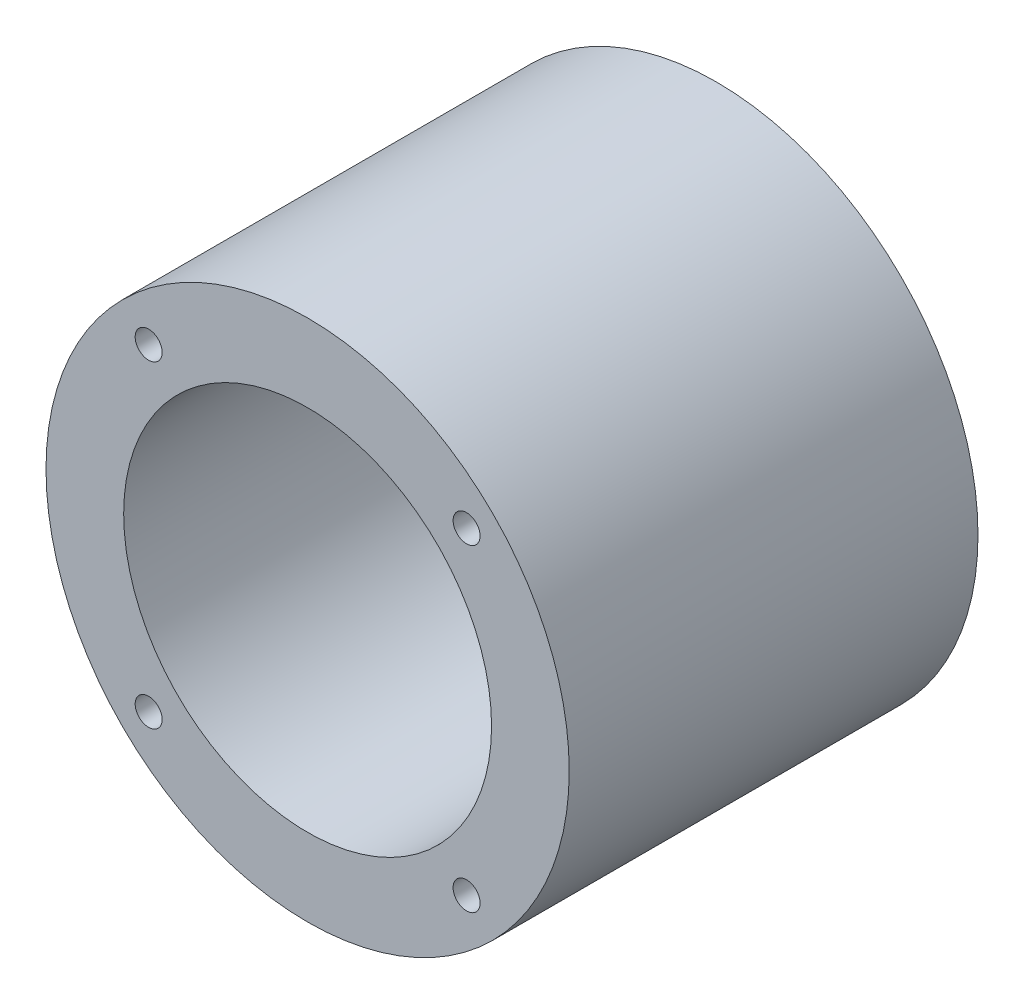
SolidWorks part; units mm, degrees
ref_plane "Ebene vorne" through (0, 0, 0) normal (0, 0, 1) x (1, 0, 0)
ref_plane "Ebene oben" through (0, 0, 0) normal (0, 1, 0) x (1, 0, 0)
ref_plane "Ebene rechts" through (0, 0, 0) normal (1, 0, 0) x (0, 0, -1)
sketch "Skizze1" plane through (0, 0, 0) normal (0, 0, 1) x (-1, 0, 0)
  line L0 (0, 72.1661) -> (0, -84.7947) construction
  line L1 (-92.4215, 0) -> (81.1335, 0) construction
  circle A0 centre (0, 0) radius 64
  circle A1 centre (-38.8909, 38.8909) radius 3.3
  circle A2 centre (38.8909, 38.8909) radius 3.3
  circle A3 centre (38.8909, -38.8909) radius 3.3
  circle A4 centre (-38.8909, -38.8909) radius 3.3
  dimension "D1" = 6.6
  dimension "D2" = 128
  dimension "D3" = 38.8909
  dimension "D4" = 38.8909
  dimension "D5" = 38.8909
  dimension "D6" = 38.8909
extrude "Aufsatz-Linear austragen1" add sketch "Skizze1" along normal blind 100
sketch "Skizze2" plane through (0, 0, 100) normal (0, 0, 1) x (1, 0, 0)
  circle A0 centre (0, 0) radius 45
  dimension "D1" = 90
extrude "Schnitt-Linear austragen1" cut sketch "Skizze2" against normal blind 100
